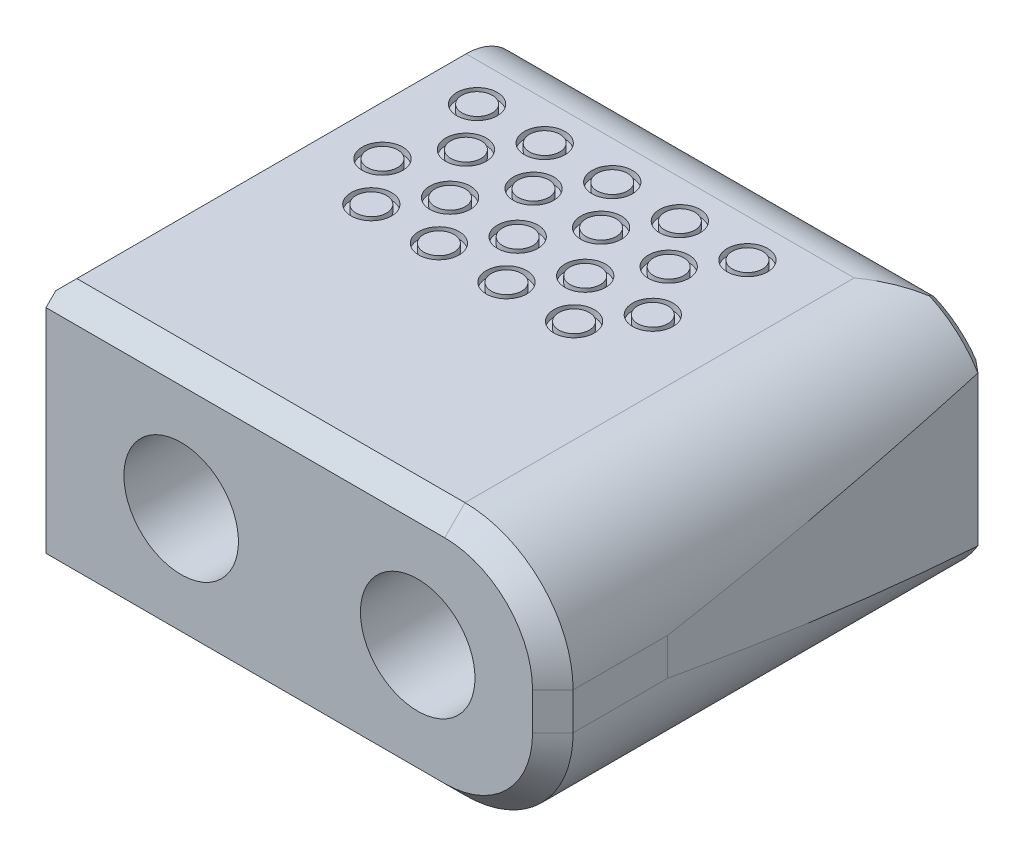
SolidWorks part; units mm, degrees
ref_plane "Front Plane" through (0, 0, 0) normal (0, 0, 1) x (1, 0, 0)
ref_plane "Top Plane" through (0, 0, 0) normal (0, 1, 0) x (1, 0, 0)
ref_plane "Right Plane" through (0, 0, 0) normal (1, 0, 0) x (0, 0, -1)
sketch "Sketch3" plane through (0, 0, 0) normal (1, 0, 0) x (0, 0, -1)
  line L1 (0, -4.7625) -> (16.9672, -4.7625)
  line L2 (0, -4.7625) -> (0, 4.7625)
  line L3 (0, 4.7625) -> (16.9672, 4.7625)
  line L4 (16.9672, -4.7625) -> (16.9672, 4.7625)
  line L6 (0, 0) -> (50000, 0) construction
  dimension "D1" = 16.9672
  dimension "D3" = 9.525
extrude "Extrude1" add sketch "Sketch3" along normal blind 19.05
hole_wizard "#6 CBORE" positions "Sketch7" profile "Sketch6" counterbore size "#6" standard "ANSI Inch"
sketch "Sketch7" plane through (0, 0, -16.9672) normal (0, 0, -1) x (-1, 0, 0)
  line L0 (0, 0) -> (50000, 0) construction
  line L1 (0, 5.2388) -> (0, -5.2388) construction
  point P0 (-5.08, 0)
  point P6 (-13.97, 0)
  dimension "D1" = 5.08
  dimension "D2" = 13.97
sketch "Sketch6" plane through (5.08, 0, -16.9672) normal (1, 0, 0) x (0, 1, 0)
  line L0 (0, 0) -> (0, 16.9672)
  line L1 (0, 16.9672) -> (2.1526, 16.9672)
  line L3 (2.1526, 16.9672) -> (2.1527, 4.064)
  line L4 (2.1527, 4.064) -> (3.302, 4.064)
  line L5 (3.302, 4.064) -> (3.302, 0)
  line L7 (3.302, 0) -> (0, 0)
  line L11 (0, -6.35) -> (0, 107.95) construction
  dimension "Thru Hole Dia." = 4.3053
  dimension "Thru Hole Depth" = 16.9672
  dimension "C'Bore Dia." = 6.604
  dimension "C'Bore Depth" = 4.064
fillet "Fillet1" radius 4.064 2 edges at (19.05, -4.7625, -8.4836) (19.05, 4.7625, -8.4836)
chamfer "Chamfer1" distance 0.3969 angle 45 5 edges at (7.493, -4.7625, -16.9672) (17.8597, -3.5722, -16.9672) (7.493, 4.7625, -16.9672) (19.05, 0, -16.9672) (17.8597, 3.5722, -16.9672)
chamfer "Chamfer2" distance 0.762 angle 45 6 edges at (0, 0, 0) (7.493, -4.7625, 0) (17.8597, -3.5722, 0) (19.05, 0, 0) (17.8597, 3.5722, 0) (7.493, 4.7625, 0)
sketch "Sketch8" plane through (0, 0, 0) normal (-1, 0, 0) x (0, 0, 1)
  line L0 (0, 0) -> (-50000, 0) construction
  line L1 (-15.3924, -4.7625) -> (-15.3924, -7.3025)
  line L2 (-21.7424, -7.3025) -> (-21.7424, -0.9525)
  line L3 (-19.2024, -0.9525) -> (-21.7424, -0.9525)
  line L4 (-15.3924, -7.3025) -> (-21.7424, -7.3025)
  line L5 (-16.9672, -4.3656) -> (-16.9672, 4.3656) construction
  line L6 (-0.762, -4.7625) -> (-16.5703, -4.7625) construction
  line L7 (-16.9672, -4.0774) -> (-17.5721, -4.0774)
  line L8 (-16.9672, 4.0774) -> (-17.5721, 4.0774)
  line L9 (-16.9672, -0.6985) -> (-16.9672, -4.3656) construction
  line L10 (-15.3924, 7.3025) -> (-21.7424, 7.3025)
  line L11 (-19.2024, 0.9525) -> (-21.7424, 0.9525)
  line L12 (-21.7424, 7.3025) -> (-21.7424, 0.9525)
  line L13 (-15.3924, 4.7625) -> (-15.3924, 7.3025)
  line L14 (-0.762, -4.7625) -> (-16.5703, -4.7625) construction
  arc A1 (-19.2024, -0.9525) -> (-17.5721, -4.0774) centre (-15.3924, -0.9525) ccw
  arc A4 (-19.2024, 0.9525) -> (-17.5721, 4.0774) centre (-15.3924, 0.9525) cw
  arc A6 (-16.9672, -4.0774) -> (-15.3924, -4.7625) centre (-15.3924, -2.61) ccw
  arc A7 (-16.9672, 4.0774) -> (-15.3924, 4.7625) centre (-15.3924, 2.61) cw
  dimension "D1" = 3.81
  dimension "D2" = 6.35
  dimension "D4" = 1.5748
extrude "Cut-Extrude2" cut sketch "Sketch8" against normal through all
sketch "Sketch5" plane through (0, 0, 0) normal (0, 1, 0) x (1, 0, 0)
  line L1 (-5.497, 4.318) -> (49994.503, 4.318) construction
  line L3 (-5.2388, 0) -> (5.2388, 0) construction
  line L5 (19.05, 4.318) -> (31.75, 4.318)
  line L6 (31.75, 4.318) -> (31.75, 29.718)
  line L7 (31.75, 29.718) -> (16.4841, 29.718)
  line L8 (19.05, 16.5703) -> (19.05, 0.762) construction
  arc A1 (19.05, 4.318) -> (16.4841, 29.718) centre (-107.95, 4.318) ccw
  dimension "D2" = 127
  dimension "D1" = 4.318
  dimension "D3" = 12.7
  dimension "D4" = 25.4
extrude "Cut-Extrude1" cut sketch "Sketch5" against normal mid plane 25
chamfer "Chamfer3" distance 0.3969 angle 45 1 edges at (18.4185, 0, -16.9672)
chamfer "Chamfer4" distance 0.3969 angle 45 5 edges at (0, -4.7625, -8.0772) (0, 4.7625, -8.0772) (0, 0, -16.9672) (0, -4.5838, -16.2511) (0, 4.5838, -16.2511)
sketch "Sketch10" plane through (0, -4.7625, 0) normal (0, -1, 0) x (1, 0, 0)
  circle A0 centre (2.2399, -13.964) radius 0.762
  circle A1 centre (2.2399, -13.964) radius 0.5715
  circle A2 centre (4.7799, -13.964) radius 0.5715
  circle A3 centre (4.7799, -13.964) radius 0.762
  circle A4 centre (7.3199, -13.964) radius 0.5715
  circle A5 centre (7.3199, -13.964) radius 0.762
  circle A6 centre (9.8599, -13.964) radius 0.5715
  circle A7 centre (9.8599, -13.964) radius 0.762
  circle A8 centre (12.3999, -13.964) radius 0.5715
  circle A9 centre (12.3999, -13.964) radius 0.762
  circle A10 centre (3.5128, -12.2713) radius 0.762
  circle A11 centre (3.5128, -12.2713) radius 0.5715
  circle A12 centre (6.0528, -12.2713) radius 0.762
  circle A13 centre (6.0528, -12.2713) radius 0.5715
  circle A14 centre (8.5928, -12.2713) radius 0.762
  circle A15 centre (8.5928, -12.2713) radius 0.5715
  circle A16 centre (11.1328, -12.2713) radius 0.762
  circle A17 centre (11.1328, -12.2713) radius 0.5715
  circle A18 centre (2.2399, -10.408) radius 0.762
  circle A19 centre (2.2399, -10.408) radius 0.5715
  circle A20 centre (4.7799, -10.408) radius 0.5715
  circle A21 centre (4.7799, -10.408) radius 0.762
  circle A22 centre (7.3199, -10.408) radius 0.5715
  circle A23 centre (7.3199, -10.408) radius 0.762
  circle A24 centre (9.8599, -10.408) radius 0.5715
  circle A25 centre (9.8599, -10.408) radius 0.762
  circle A26 centre (12.3999, -10.408) radius 0.5715
  circle A27 centre (12.3999, -10.408) radius 0.762
  circle A28 centre (3.5128, -8.7153) radius 0.762
  circle A29 centre (3.5128, -8.7153) radius 0.5715
  circle A30 centre (6.0528, -8.7153) radius 0.762
  circle A31 centre (6.0528, -8.7153) radius 0.5715
  circle A32 centre (8.5928, -8.7153) radius 0.762
  circle A33 centre (8.5928, -8.7153) radius 0.5715
  circle A34 centre (11.1328, -8.7153) radius 0.762
  circle A35 centre (11.1328, -8.7153) radius 0.5715
  dimension "D3" = 5
  dimension "D4" = 2
extrude "Cut-Extrude3" cut sketch "Sketch10" against normal blind 0.254
mirror "Mirror1" about plane through (0, 0, 0) normal (0, 1, 0) of "Cut-Extrude3"
